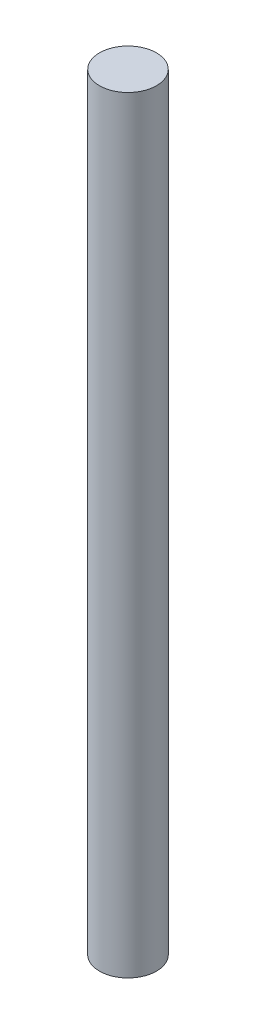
SolidWorks part; units mm, degrees
ref_plane "Ebene vorne" through (0, 0, 0) normal (0, 0, 1) x (1, 0, 0)
ref_plane "Ebene oben" through (0, 0, 0) normal (0, 1, 0) x (1, 0, 0)
ref_plane "Ebene rechts" through (0, 0, 0) normal (1, 0, 0) x (0, 0, -1)
sketch "Skizze1" plane through (0, 0, 0) normal (0, 1, 0) x (1, 0, 0)
  circle A0 centre (0, 0) radius 4
extrude "Aufsatz-Linear austragen1" add sketch "Skizze1" along normal blind 107.65
